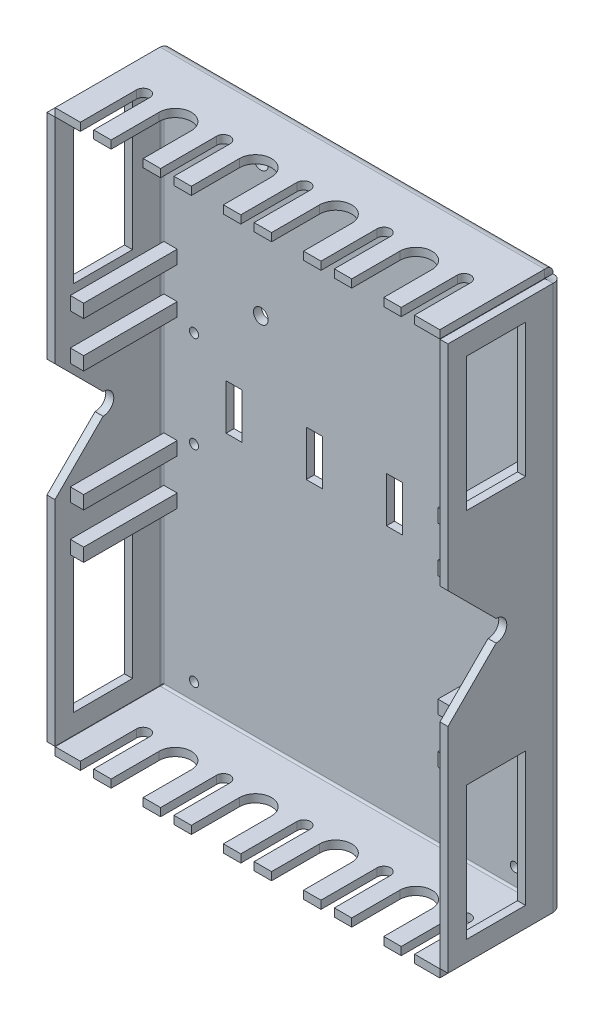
SolidWorks part; units mm, degrees
ref_plane "Plan de face" through (0, 0, 0) normal (0, 0, 1) x (1, 0, 0)
ref_plane "Plan de dessus" through (0, 0, 0) normal (0, 1, 0) x (1, 0, 0)
ref_plane "Plan de droite" through (0, 0, 0) normal (1, 0, 0) x (0, 0, -1)
imported_body "Importée1"
hole_wizard "Dégagement M31" positions "Esquisse1" profile "Esquisse2" hole size "M3" standard "ISO"
sketch "Esquisse1" plane through (0, 0, -3) normal (0, 0, -1) x (-1, 0, 0)
  point P0 (-60, 18)
  point P3 (-60, -18)
  point P6 (60, -18)
  point P9 (60, 18)
  dimension "D1" = 36
  dimension "D2" = 120
  dimension "D3" = 60
  dimension "D4" = 18
sketch "Esquisse2" plane through (60, 18, -3) normal (1, 0, 0) x (0, 1, 0)
  line L0 (0, 0) -> (0, 43.0001)
  line L1 (0, 43.0001) -> (1.7, 43.0001)
  line L2 (1.7, 43.0001) -> (1.7, 0)
  line L5 (1.7, 0) -> (0, 0)
  line L11 (0, -6.35) -> (0, 107.95) construction
  dimension "Diamètre du perçage jusqu'au prochain" = 3.4
  dimension "Profondeur du perçage jusqu'au prochain" = 43.0001
hole_wizard "Dégagement M51" positions "Esquisse3" profile "Esquisse4" hole size "M5" standard "ISO"
sketch "Esquisse3" plane through (0, 0, 0) normal (0, 0, 1) x (1, 0, 0)
  line L0 (0, 0) -> (0, -105) construction
  line L1 (-2.5, -105) -> (2.5, -105) construction
  line L2 (0, 0) -> (-18, 0) construction
  line L3 (-18, 8.5) -> (-18, -8.5) construction
  point P0 (35, -36)
  point P2 (35, -86)
  point P4 (-35, -36)
  point P6 (-35, -86)
  point P20 (-35, 86)
  point P21 (-35, 36)
  point P22 (35, 86)
  point P23 (35, 36)
  dimension "D1" = 70
  dimension "D2" = 50
  dimension "D3" = 36
sketch "Esquisse4" plane through (35, -36, 0) normal (1, 0, 0) x (0, -1, 0)
  line L0 (0, 0) -> (0, 3)
  line L1 (0, 3) -> (2.75, 3)
  line L2 (2.75, 3) -> (2.75, 0)
  line L5 (2.75, 0) -> (0, 0)
  line L11 (0, -6.35) -> (0, 107.95) construction
  dimension "Diamètre du perçage jusqu'au prochain" = 5.5
  dimension "Profondeur du perçage jusqu'au prochain" = 3
hole_wizard "Dégagement M32" positions "Esquisse5" profile "Esquisse6" hole size "M3" standard "ISO"
sketch "Esquisse5" plane through (0, 0, -3) normal (0, 0, -1) x (-1, 0, 0)
  line L0 (0, 0) -> (0, -104.2791) construction
  line L1 (0, -105) -> (0, -102) construction
  line L3 (0, 0) -> (-75, 0) construction
  line L4 (-75, 0) -> (-72, 0) construction
  line L6 (-75, -22) -> (-75, -4) construction
  point P0 (-60, -95)
  point P2 (-60, 95)
  point P15 (60, 95)
  point P16 (60, -95)
  dimension "D2" = 190
sketch "Esquisse6" plane through (60, -95, -3) normal (1, 0, 0) x (0, 1, 0)
  line L0 (0, 0) -> (0, 43.0001)
  line L1 (0, 43.0001) -> (1.7, 43.0001)
  line L2 (1.7, 43.0001) -> (1.7, 0)
  line L5 (1.7, 0) -> (0, 0)
  line L11 (0, -6.35) -> (0, 107.95) construction
  dimension "Diamètre du perçage jusqu'au prochain" = 3.4
  dimension "Profondeur du perçage jusqu'au prochain" = 43.0001
sketch "Esquisse7" plane through (0, 0, -3) normal (0, 0, -1) x (-1, 0, 0)
  circle A0 centre (-35, -86) radius 2.75 construction
  circle A1 centre (35, -86) radius 2.75 construction
  circle A2 centre (35, -36) radius 2.75 construction
  circle A3 centre (-35, -36) radius 2.75 construction
  circle A4 centre (-35, -86) radius 2.75
  circle A5 centre (35, -86) radius 2.75
  circle A6 centre (35, -36) radius 2.75
  circle A7 centre (-35, -36) radius 2.75
extrude "Boss.-Extru.1" add sketch "Esquisse7" against normal up to surface (3 mm away)
